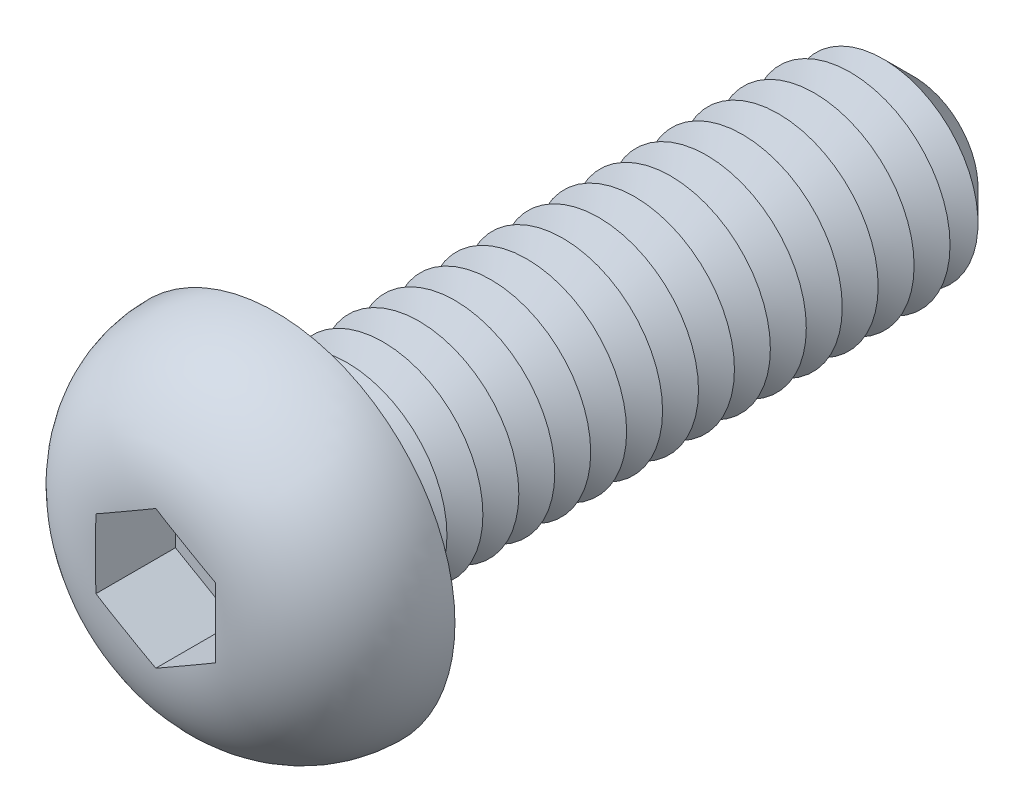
SolidWorks part; units mm, degrees
ref_plane "Front Plane" through (0, 0, 0) normal (0, 0, 1) x (1, 0, 0)
ref_plane "Top Plane" through (0, 0, 0) normal (0, 1, 0) x (1, 0, 0)
ref_plane "Right Plane" through (0, 0, 0) normal (1, 0, 0) x (0, 0, -1)
sketch "Sketch1" plane through (0, 0, 0) normal (1, 0, 0) x (0, 0, -1)
  line L0 (-47.9342, 0) -> (60.3146, 0) construction
sketch "Sketch2" plane through (0, 0, 0) normal (1, 0, 0) x (0, 0, -1)
  line L0 (0, 0) -> (-1.5, 0)
  line L1 (-47.9342, 0) -> (60.3146, 0) construction
  line L2 (-1.5, 0) -> (-1.5, 0.75)
  line L3 (0, 2.25) -> (0, 0)
  arc A0 (-1.5, 0.75) -> (0, 2.25) centre (0, 0.75) cw
  dimension "D1" = 1.5
  dimension "D2" = 1.5
  dimension "D3" = 2.25
revolve "Revolve1" add sketch "Sketch2" angle 360 about L0
sketch "Sketch3" plane through (0, 0, 1.5) normal (0, 0, 1) x (1, 0, 0)
  line L1 (0, 0.866) -> (-0.75, 0.433)
  line L2 (-0.75, 0.433) -> (-0.75, -0.433)
  line L3 (-0.75, -0.433) -> (0, -0.866)
  line L4 (0, -0.866) -> (0.75, -0.433)
  line L5 (0.75, -0.433) -> (0.75, 0.433)
  line L6 (0.75, 0.433) -> (0, 0.866)
  circle A0 centre (0, 0) radius 0.75 construction
  dimension "D1" = 1.5
extrude "Cut-Extrude1" cut sketch "Sketch3" against normal blind 1
sketch "Sketch4" plane through (0, 0, 0) normal (0, 0, -1) x (-1, 0, 0)
  circle A0 centre (0, 0) radius 1.25
  dimension "D1" = 2.5
extrude "Boss-Extrude1" add sketch "Sketch4" along normal blind 8
chamfer "Chamfer1" distance 0.45 angle 45 1 edges at (-1.25, 0, -8)
sketch "Sketch5" plane through (0, 0, 0) normal (1, 0, 0) x (0, 0, -1)
  line L0 (0.45, 1.25) -> (0.9, 1.25)
  line L1 (7.55, 1.25) -> (0, 1.25) construction
  line L2 (0.9, 1.25) -> (0.675, 0.8603)
  line L3 (0.675, 0.8603) -> (0.45, 1.25)
  line L4 (0, -2.25) -> (0, 2.25) construction
  line L5 (7.55, 1.25) -> (0, 1.25) construction
  dimension "D1" = 0.45
  dimension "D2" = 0.45
revolve "Cut-Revolve1" cut sketch "Sketch5" angle 360 about L0
pattern_linear "LPattern1" count 16 spacing 0.45 along (0, 0, -1) of "Cut-Revolve1"
fillet "Fillet2" radius 0.225 1 edges at (1.25, 0, 0)
sketch "Sketch6" plane through (0, 0, 0.5) normal (0, 0, 1) x (1, 0, 0)
  circle A0 centre (0, 0) radius 0.45
  dimension "D1" = 0.9
extrude "Cut-Extrude2" cut sketch "Sketch6" against normal up to surface (8.5 mm away)
